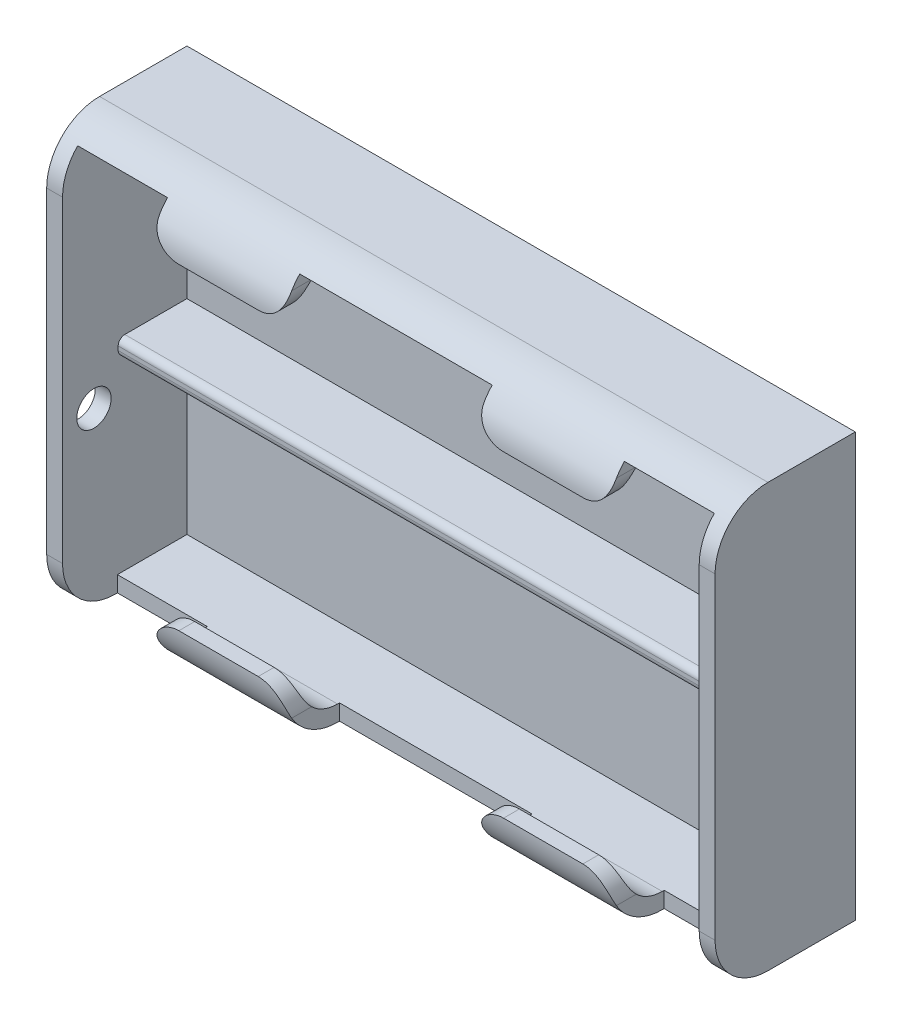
SolidWorks part; units mm, degrees
ref_plane "Face" through (0, 0, 0) normal (0, 0, 1) x (1, 0, 0)
ref_plane "Dessus" through (0, 0, 0) normal (0, 1, 0) x (1, 0, 0)
ref_plane "Droite" through (0, 0, 0) normal (1, 0, 0) x (0, 0, -1)
sketch "Esquisse1" plane through (0, 0, 0) normal (0, 0, 1) x (1, 0, 0)
  line L1 (0, 0) -> (50.56, 0)
  line L2 (0, 0) -> (0, 32)
  line L3 (0, 32) -> (50.56, 32)
  line L4 (50.56, 0) -> (50.56, 32)
  dimension "D1" = 50.56
  dimension "D2" = 32
extrude "Base-Extrusion" add sketch "Esquisse1" against normal blind 10.61
fillet "Congé1" radius 4 2 edges at (25.28, 32, 0) (25.28, 0, 0)
shell "Coque1" thickness 1.2
sketch "Esquisse2" plane through (0, 0, 0) normal (0, 0, 1) x (1, 0, 0)
  line L0 (1.8981, 26) -> (52.8187, 26) construction
  line L1 (1.2, 30.8) -> (49.36, 30.8) construction
  line L2 (1.2, 30.8) -> (1.2, 1.2) construction
  line L3 (1.2, 1.2) -> (49.36, 1.2) construction
  line L4 (49.36, 1.2) -> (49.36, 30.8) construction
  line L5 (8, 29.9549) -> (8, -5.9984) construction
  line L6 (18, 29.9549) -> (18, -3.6994) construction
  line L7 (25.28, 39.2756) -> (25.28, -0.0623) construction
  line L8 (4.4734, 23) -> (19.289, 23) construction
  line L9 (-2.1681, 16) -> (51.7938, 16) construction
  line L10 (1.2, 1.2) -> (1.2, 30.8)
  line L11 (1.2, 30.8) -> (8, 30.8)
  line L12 (8, 30.8) -> (8, 27.6177)
  line L13 (8, 27.6177) -> (18, 27.6177)
  line L14 (18, 27.6177) -> (18, 30.8)
  line L15 (18, 30.8) -> (32.56, 30.8)
  line L16 (32.56, 27.6177) -> (32.56, 30.8)
  line L17 (42.56, 27.6177) -> (32.56, 27.6177)
  line L18 (42.56, 30.8) -> (42.56, 27.6177)
  line L19 (49.36, 30.8) -> (42.56, 30.8)
  line L20 (49.36, 1.2) -> (49.36, 30.8)
  line L21 (1.2, 1.2) -> (8, 1.2)
  line L22 (8, 1.2) -> (8, 4.3823)
  line L23 (8, 4.3823) -> (18, 4.3823)
  line L24 (18, 4.3823) -> (18, 1.2)
  line L25 (18, 1.2) -> (32.56, 1.2)
  line L26 (32.56, 4.3823) -> (32.56, 1.2)
  line L27 (42.56, 4.3823) -> (32.56, 4.3823)
  line L28 (42.56, 1.2) -> (42.56, 4.3823)
  line L29 (49.36, 1.2) -> (42.56, 1.2)
  line L30 (50.56, 0) -> (0, 0) construction
  line L31 (0, 32) -> (50.56, 32) construction
  point P23 (25.28, 30.8)
  point P24 (25.28, 30.8)
  point P27 (49.36, 16)
  point P29 (1.2, 16)
  point P35 (1.2, 16)
  point P38 (49.36, 16)
  dimension "D1" = 1.2
  dimension "D2" = 1.2
extrude "Enlèv. mat.-Extru.1" cut sketch "Esquisse2" against normal blind 9.4
sketch "Esquisse3" plane through (0, 0, -9.41) normal (0, 0, 1) x (1, 0, 0)
  line L0 (0, 16) -> (50.56, 16) construction
  line L1 (49.4809, 15.35) -> (49.4809, 16.65)
  line L2 (1.0423, 15.35) -> (49.4809, 15.35)
  line L3 (1.0423, 16.65) -> (49.4809, 16.65)
  line L4 (1.0423, 16.65) -> (1.0423, 15.35)
  line L5 (0, 28) -> (0, 4) construction
  line L6 (50.56, 4) -> (50.56, 28) construction
  dimension "D1" = 1.3
extrude "Boss.-Extru.1" add sketch "Esquisse3" along normal blind 5.2
fillet "Congé2" radius 0.5 2 edges at (25.28, 15.35, -4.21) (25.28, 16.65, -4.21)
fillet "Congé3" radius 2 8 edges at (8, 28, -0.6) (18, 28, -0.6) (32.56, 28, -0.6) (42.56, 28, -0.6) (42.56, 4, -0.6) (32.56, 4, -0.6) (18, 4, -0.6) (8, 4, -0.6)
sketch "Esquisse4" plane through (0, 0, 0) normal (0, 0, 1) x (1, 0, 0)
  line L0 (1.2, 29.0464) -> (1.2, -4.269) construction
  line L1 (8, -3.2909) -> (8, 30.758) construction
  line L2 (18, -4.269) -> (18, 30.758) construction
  line L3 (32.56, -2.1906) -> (32.56, 29.9634) construction
  line L4 (42.56, -4.269) -> (42.56, 31.3082) construction
  line L5 (-1.4029, 24.8) -> (52.5742, 24.8) construction
  line L6 (49.36, 29.0464) -> (49.36, -5.4916) construction
  line L7 (51.9629, 1.2) -> (-1.8308, 1.2) construction
  line L8 (1.2, 27.3959) -> (8, 27.3959)
  line L9 (8, 27.3959) -> (8, 19.6325)
  line L10 (8, 19.6325) -> (18, 19.6325)
  line L11 (18, 19.6325) -> (18, 28.4963)
  line L12 (18, 28.4963) -> (32.56, 28.4963)
  line L13 (32.56, 28.4963) -> (32.56, 20.6106)
  line L14 (32.56, 20.6106) -> (42.56, 20.6106)
  line L15 (42.56, 20.6106) -> (42.56, 29.0464)
  line L16 (42.56, 29.0464) -> (49.36, 28.4963)
  line L17 (49.36, 28.4963) -> (49.36, -2.6797)
  line L18 (49.36, -2.6797) -> (42.56, -2.6797)
  line L19 (42.56, -2.6797) -> (42.56, 6.9788)
  line L20 (42.56, 6.9788) -> (32.56, 6.9788)
  line L21 (32.56, 6.9788) -> (32.56, -0.968)
  line L22 (32.56, -0.968) -> (18, -0.968)
  line L23 (18, -0.968) -> (18, 5.7562)
  line L24 (18, 5.7562) -> (8, 5.7562)
  line L25 (8, 5.7562) -> (8, -1.6405)
  line L26 (8, -1.6405) -> (1.2, -1.6405)
  line L27 (1.2, -1.6405) -> (1.2, 27.3959)
extrude "Enlèv. mat.-Extru.2" cut sketch "Esquisse4" against normal blind 4.15
sketch "Esquisse5" plane through (0, 0, 0) normal (-1, 0, 0) x (0, 0, 1)
  circle A0 centre (-2.3764, 12.9801) radius 1.3
extrude "Enlèv. mat.-Extru.3" cut sketch "Esquisse5" against normal blind 3
